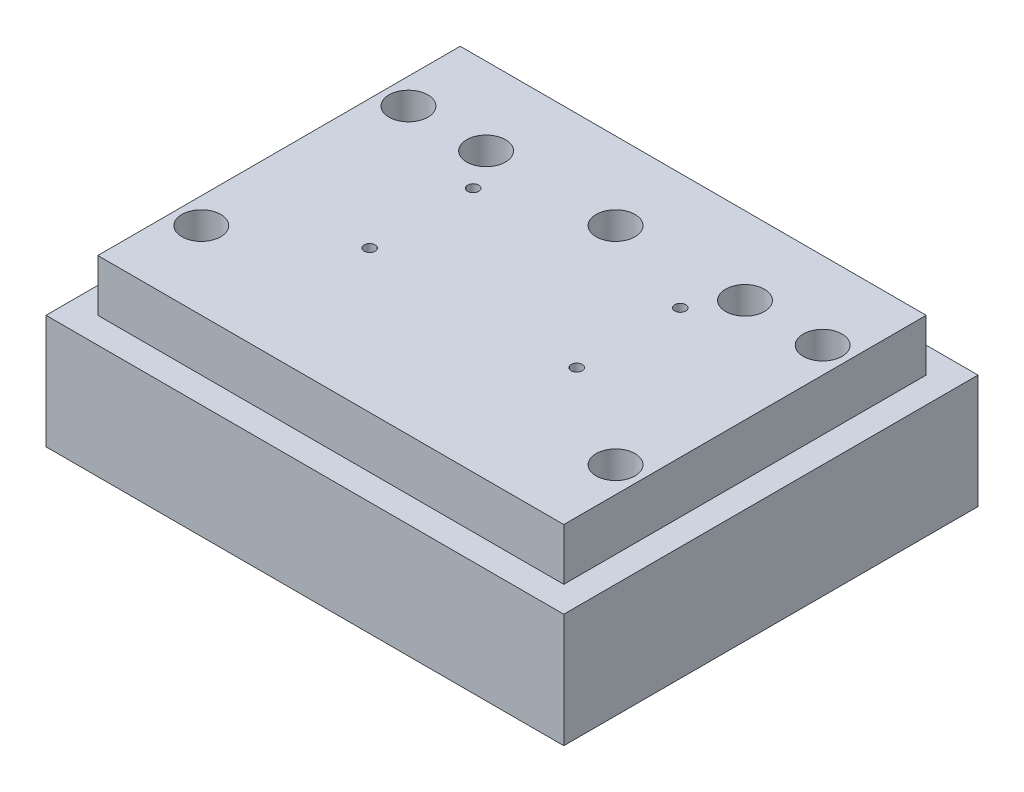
SolidWorks part; units mm, degrees
ref_plane "Front Plane" through (0, 0, 0) normal (0, 0, 1) x (1, 0, 0)
ref_plane "Top Plane" through (0, 0, 0) normal (0, 1, 0) x (1, 0, 0)
ref_plane "Right Plane" through (0, 0, 0) normal (1, 0, 0) x (0, 0, -1)
sketch "Sketch1" plane through (0, 0, 0) normal (0, 1, 0) x (1, 0, 0)
  line L1 (-46.7964, 20.7984) -> (80.2036, 20.7984)
  line L2 (-46.7964, 20.7984) -> (-46.7964, -80.8016)
  line L3 (-46.7964, -80.8016) -> (80.2036, -80.8016)
  line L4 (80.2036, 20.7984) -> (80.2036, -80.8016)
  dimension "D1" = 127
extrude "Boss-Extrude1" add sketch "Sketch1" along normal blind 27.94
sketch "Sketch2" plane through (0, 27.94, 0) normal (0, 1, 0) x (1, 0, 0)
  line L0 (-46.7964, 20.7984) -> (-46.7964, -80.8016) construction
  line L1 (-40.4464, 14.4484) -> (73.8536, 14.4484)
  line L2 (-40.4464, 14.4484) -> (-40.4464, -74.4516)
  line L3 (-40.4464, -74.4516) -> (73.8536, -74.4516)
  line L4 (73.8536, 14.4484) -> (73.8536, -74.4516)
  line L5 (80.2036, 20.7984) -> (-46.7964, 20.7984) construction
  dimension "D1" = 114.3
  dimension "D2" = 88.9
  dimension "D3" = 6.35
  dimension "D4" = 6.35
extrude "Boss-Extrude2" add sketch "Sketch2" along normal blind 12.7
hole_wizard "3/8 (0.375) Diameter Hole1" positions "Sketch3" profile "Sketch4" hole size "3/8" standard "ANSI Inch"
sketch "Sketch3" plane through (0, 40.64, 0) normal (0, 1, 0) x (1, 0, 0)
  line L0 (-40.4464, 14.4484) -> (-40.4464, -74.4516) construction
  line L1 (73.8536, -74.4516) -> (73.8536, 14.4484) construction
  line L2 (73.8536, 14.4484) -> (-40.4464, 14.4484) construction
  point P0 (-34.0964, -4.6016)
  point P8 (67.5036, -4.6016)
  point P17 (-34.0964, -55.4016)
  point P19 (67.5036, -55.4016)
  dimension "D1" = 6.35
  dimension "D6" = 6.35
  dimension "D7" = 19.05
  dimension "D8" = 50.8
  dimension "D9" = 50.8
sketch "Sketch4" plane through (-34.0964, 40.64, 4.6016) normal (1, 0, 0) x (0, 0, 1)
  line L0 (0, 0) -> (0, 40.64)
  line L1 (0, 40.64) -> (4.7625, 40.64)
  line L2 (4.7625, 40.64) -> (4.7625, 0)
  line L5 (4.7625, 0) -> (0, 0)
  line L11 (0, -6.35) -> (0, 107.95) construction
  dimension "Thru Hole Dia." = 9.525
  dimension "Thru Hole Depth" = 40.64
hole_wizard "3/8 (0.375) Diameter Hole2" positions "Sketch5" profile "Sketch7" hole size "3/8" standard "ANSI Inch"
sketch "Sketch5" plane through (0, 40.64, 0) normal (0, 1, 0) x (1, 0, 0)
  line L0 (-40.4464, 14.4484) -> (-40.4464, -74.4516) construction
  line L1 (73.8536, -74.4516) -> (73.8536, 14.4484) construction
  line L2 (73.8536, 14.4484) -> (-40.4464, 14.4484) construction
  point P0 (-15.0464, -4.6016)
  point P2 (16.7036, -4.6016)
  point P4 (48.4536, -4.6016)
  dimension "D1" = 25.4
  dimension "D2" = 31.75
  dimension "D3" = 31.75
  dimension "D4" = 25.4
  dimension "D5" = 19.05
sketch "Sketch7" plane through (-15.0464, 40.64, 4.6016) normal (1, 0, 0) x (0, 0, 1)
  line L0 (0, 0) -> (0, 35.8816)
  line L1 (0, 35.8816) -> (4.7625, 33.02)
  line L2 (4.7625, 33.02) -> (4.7625, 0)
  line L5 (4.7625, 0) -> (0, 0)
  line L10 (0, 35.8816) -> (-4.7625, 33.02) construction
  line L11 (0, -6.35) -> (0, 107.95) construction
  dimension "Hole Dia." = 9.525
  dimension "Hole Depth" = 33.02
  dimension "Drill Angle" = 118
hole_wizard "3/8-24 Tapped Hole1" positions "Sketch8" profile "Sketch9" tap size "3/8-24" standard "ANSI Inch"
sketch "Sketch8" plane through (0, 0, -20.7984) normal (0, 0, -1) x (-1, 0, 0)
  line L0 (-80.2036, 27.94) -> (-80.2036, 0) construction
  line L2 (-80.2036, 0) -> (46.7964, 0) construction
  point P0 (-16.7036, 12.7)
  dimension "D1" = 63.5
  dimension "D2" = 12.7
sketch "Sketch9" plane through (16.7036, 12.7, -20.7984) normal (1, 0, 0) x (0, 1, 0)
  line L0 (0, 0) -> (0, 27.9335)
  line L1 (0, 27.9335) -> (4.2164, 25.4)
  line L2 (4.2164, 25.4) -> (4.2164, 0)
  line L5 (4.2164, 0) -> (0, 0)
  line L10 (0, 27.9335) -> (-4.2164, 25.4) construction
  line L11 (0, -6.35) -> (0, 107.95) construction
  dimension "Tap Drill Dia." = 8.4328
  dimension "Tap Drill Depth" = 25.4
  dimension "Drill Angle" = 118
hole_wizard "3/8 (0.375) Diameter Hole3" positions "Sketch12" profile "Sketch11" hole size "3/8" standard "ANSI Inch"
sketch "Sketch12" plane through (0, 0, -20.7984) normal (0, 0, -1) x (-1, 0, 0)
  line L0 (-80.2036, 27.94) -> (-80.2036, 0) construction
  line L2 (-80.2036, 0) -> (46.7964, 0) construction
  point P0 (-48.4536, 12.7)
  point P2 (15.0464, 12.7)
  dimension "D1" = 31.75
  dimension "D2" = 63.5
  dimension "D3" = 12.7
  dimension "D4" = 12.7
sketch "Sketch11" plane through (48.4536, 12.7, -20.7984) normal (1, 0, 0) x (0, 1, 0)
  line L0 (0, 0) -> (0, 28.2616)
  line L1 (0, 28.2616) -> (4.7625, 25.4)
  line L2 (4.7625, 25.4) -> (4.7625, 0)
  line L5 (4.7625, 0) -> (0, 0)
  line L10 (0, 28.2616) -> (-4.7625, 25.4) construction
  line L11 (0, -6.35) -> (0, 107.95) construction
  dimension "Hole Dia." = 9.525
  dimension "Hole Depth" = 25.4
  dimension "Drill Angle" = 118
hole_wizard "#6-32 Tapped Hole1" positions "Sketch13" profile "Sketch14" tap size "#6-32" standard "ANSI Inch"
sketch "Sketch13" plane through (0, 40.64, 0) normal (0, 1, 0) x (1, 0, 0)
  line L0 (-40.4464, 14.4484) -> (-40.4464, -74.4516) construction
  line L1 (73.8536, 14.4484) -> (-40.4464, 14.4484) construction
  point P0 (-8.6964, -14.1266)
  point P2 (42.1036, -14.1266)
  point P4 (42.1036, -39.5266)
  point P6 (-8.6964, -39.5266)
  dimension "D1" = 25.4
  dimension "D2" = 25.4
  dimension "D3" = 50.8
  dimension "D4" = 50.8
  dimension "D5" = 31.75
  dimension "D6" = 28.575
sketch "Sketch14" plane through (-8.6964, 40.64, 14.1266) normal (1, 0, 0) x (0, 0, 1)
  line L0 (0, 0) -> (0, 8.4327)
  line L1 (0, 8.4327) -> (1.3525, 7.62)
  line L2 (1.3525, 7.62) -> (1.3525, 0)
  line L5 (1.3525, 0) -> (0, 0)
  line L10 (0, 8.4327) -> (-1.3526, 7.62) construction
  line L11 (0, -6.35) -> (0, 107.95) construction
  dimension "Tap Drill Dia." = 2.7051
  dimension "Tap Drill Depth" = 7.62
  dimension "Drill Angle" = 118
sketch "Sketch15" plane through (0, 0, -20.7984) normal (0, 0, -1) x (-1, 0, 0)
  line L1 (-63.0586, 18.415) -> (-33.8486, 18.415)
  line L2 (-63.0586, 18.415) -> (-63.0586, 6.985)
  line L3 (-63.0586, 6.985) -> (-33.8486, 6.985)
  line L4 (-33.8486, 18.415) -> (-33.8486, 6.985)
  line L6 (4.6324, 18.415) -> (25.4604, 18.415)
  line L7 (4.6324, 18.415) -> (4.6324, 6.985)
  line L8 (4.6324, 6.985) -> (25.4604, 6.985)
  line L9 (25.4604, 18.415) -> (25.4604, 6.985)
  circle A0 centre (-48.4536, 12.7) radius 4.7625 construction
  circle A1 centre (15.0464, 12.7) radius 4.7625 construction
  dimension "D1" = 29.21
  dimension "D2" = 11.43
  dimension "D3" = 14.605
  dimension "D4" = 5.715
  dimension "D5" = 20.828
  dimension "D6" = 11.43
  dimension "D7" = 5.715
  dimension "D8" = 10.414
extrude "Cut-Extrude1" cut sketch "Sketch15" against normal blind 12.7
hole_wizard "#4-40 Tapped Hole1" positions "Sketch16" profile "Sketch17" tap size "#4-40" standard "ANSI Inch"
sketch "Sketch16" plane through (0, 0, -20.7984) normal (0, 0, -1) x (-1, 0, 0)
  line L0 (-33.8486, 18.415) -> (-63.0586, 18.415) construction
  line L2 (25.4604, 18.415) -> (4.6324, 18.415) construction
  circle A0 centre (-48.4536, 12.7) radius 4.7625 construction
  circle A1 centre (15.0464, 12.7) radius 4.7625 construction
  point P0 (-65.116, 12.7)
  point P2 (-31.7912, 12.7)
  point P4 (2.5496, 12.7)
  point P6 (27.5432, 12.7)
  dimension "D1" = 33.3248
  dimension "D2" = 24.9936
  dimension "D3" = 16.6624
  dimension "D4" = 5.715
  dimension "D5" = 12.4968
  dimension "D6" = 5.715
sketch "Sketch17" plane through (65.116, 12.7, -20.7984) normal (1, 0, 0) x (0, 1, 0)
  line L0 (0, 0) -> (0, 10.2042)
  line L1 (0, 10.2042) -> (1.1303, 9.525)
  line L2 (1.1303, 9.525) -> (1.1303, 0)
  line L5 (1.1303, 0) -> (0, 0)
  line L10 (0, 10.2042) -> (-1.1303, 9.525) construction
  line L11 (0, -6.35) -> (0, 107.95) construction
  dimension "Tap Drill Dia." = 2.2606
  dimension "Tap Drill Depth" = 9.525
  dimension "Drill Angle" = 118
